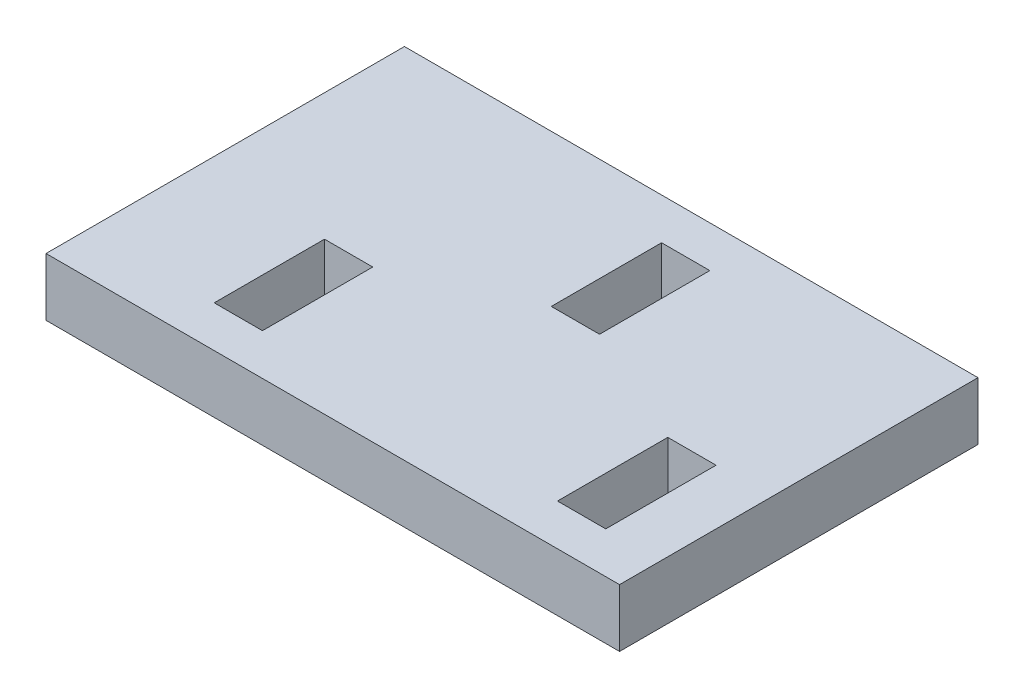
SolidWorks part; units mm, degrees
ref_plane "Front Plane" through (0, 0, 0) normal (0, 0, 1) x (1, 0, 0)
ref_plane "Top Plane" through (0, 0, 0) normal (0, 1, 0) x (1, 0, 0)
ref_plane "Right Plane" through (0, 0, 0) normal (1, 0, 0) x (0, 0, -1)
sketch "Sketch1" plane through (0, 0, 0) normal (0, 1, 0) x (1, 0, 0)
  line L1 (-26.416, -16.51) -> (26.416, -16.51)
  line L2 (-26.416, -16.51) -> (-26.416, 16.51)
  line L3 (-26.416, 16.51) -> (26.416, 16.51)
  line L4 (26.416, -16.51) -> (26.416, 16.51)
  line L5 (-26.416, -16.51) -> (26.416, 16.51) construction
  line L6 (-26.416, 16.51) -> (26.416, -16.51) construction
  point P0 (0, 0)
  dimension "D1" = 33.02
  dimension "D2" = 52.832
extrude "Boss-Extrude1" add sketch "Sketch1" along normal blind 5.334
sketch "Sketch2" plane through (0, 5.334, 0) normal (0, 1, 0) x (1, 0, 0)
  line L0 (16.891, -12.7) -> (16.891, -2.54) construction
  line L1 (16.891, -2.54) -> (21.336, -2.54) construction
  line L2 (21.336, -2.54) -> (21.336, -12.7) construction
  line L3 (21.336, -12.7) -> (16.891, -12.7) construction
  line L4 (5.5245, 2.54) -> (1.0795, 2.54) construction
  line L5 (5.5245, 12.7) -> (5.5245, 2.54) construction
  line L6 (1.0795, 12.7) -> (5.5245, 12.7) construction
  line L7 (1.0795, 2.54) -> (1.0795, 12.7) construction
  line L8 (-10.287, -2.54) -> (-10.287, -12.7) construction
  line L9 (-14.732, -12.7) -> (-14.732, -2.54) construction
  line L10 (-10.287, -12.7) -> (-14.732, -12.7) construction
  line L11 (-14.732, -2.54) -> (-10.287, -2.54) construction
  line L12 (16.891, -12.7) -> (16.891, -2.54)
  line L13 (16.891, -2.54) -> (21.336, -2.54)
  line L14 (21.336, -2.54) -> (21.336, -12.7)
  line L15 (21.336, -12.7) -> (16.891, -12.7)
  line L16 (5.5245, 2.54) -> (1.0795, 2.54)
  line L17 (5.5245, 12.7) -> (5.5245, 2.54)
  line L18 (1.0795, 12.7) -> (5.5245, 12.7)
  line L19 (1.0795, 2.54) -> (1.0795, 12.7)
  line L20 (-10.287, -2.54) -> (-10.287, -12.7)
  line L21 (-14.732, -12.7) -> (-14.732, -2.54)
  line L22 (-10.287, -12.7) -> (-14.732, -12.7)
  line L23 (-14.732, -2.54) -> (-10.287, -2.54)
extrude "Cut-Extrude1" cut sketch "Sketch2" against normal through all
equation "\"material\"=\"MDF@Platform.assembly\""
equation "\"D1@Boss-Extrude1\"=\"material\""
